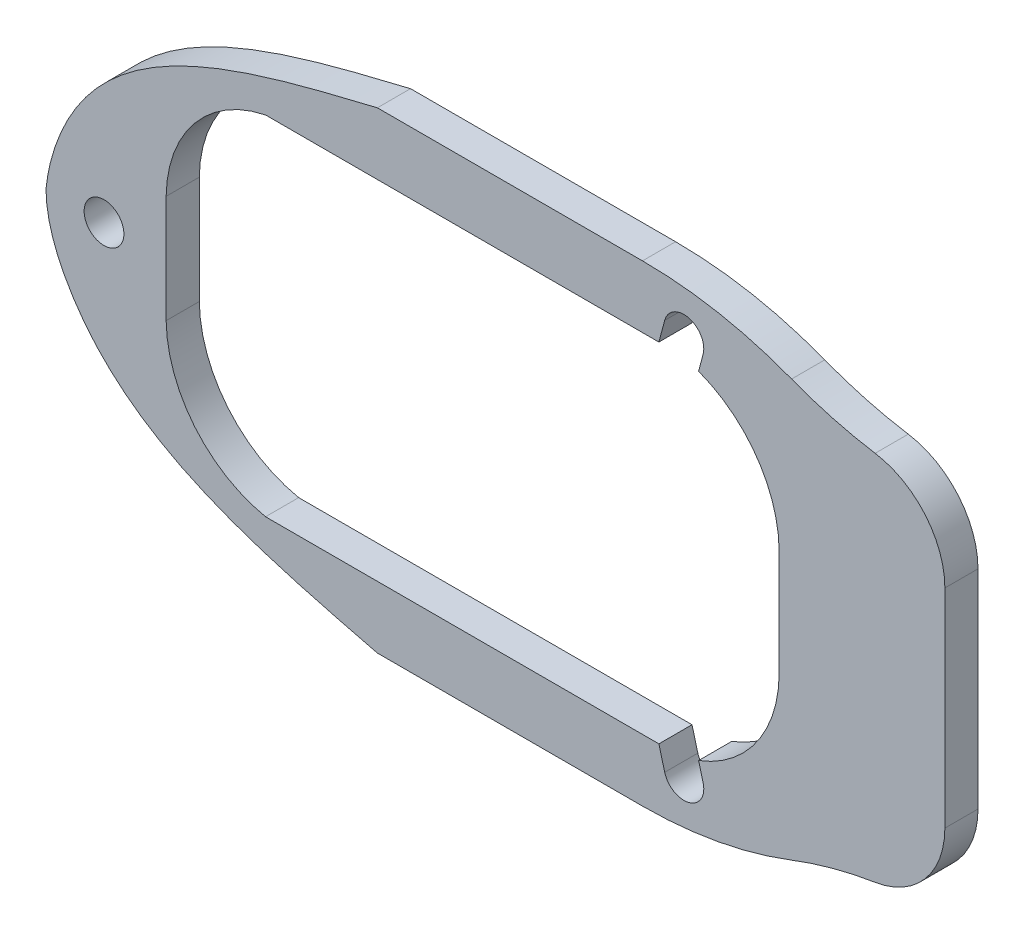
SolidWorks part; units mm, degrees
ref_plane "Face" through (0, 0, 0) normal (0, 0, 1) x (1, 0, 0)
ref_plane "Dessus" through (0, 0, 0) normal (0, 1, 0) x (1, 0, 0)
ref_plane "Droite" through (0, 0, 0) normal (1, 0, 0) x (0, 0, -1)
sketch "Esquisse1" plane through (0, 0, 0) normal (0, 0, 1) x (1, 0, 0)
  line L0 (-174.1176, 40.611) -> (-158.1176, 40.611)
  line L1 (-174.1176, 12.111) -> (-158.1176, 12.111)
  line L4 (-139.8676, 26.361) -> (-241.3155, 26.361) construction
  line L7 (-194.1176, 26.361) -> (-194.1176, 51.1644) construction
  line L13 (-139.8676, 32.6371) -> (-139.8676, 20.085)
  arc A0 (-144.076, 15.148) -> (-149.1176, 13.7872) centre (-140.1176, -9.5366) ccw
  arc A1 (-149.1176, 13.7872) -> (-158.1176, 12.111) centre (-158.1176, 37.111) cw
  arc A2 (-149.1176, 38.9348) -> (-158.1176, 40.611) centre (-158.1176, 15.611) ccw
  arc A3 (-144.076, 37.574) -> (-149.1176, 38.9348) centre (-140.1176, 62.2586) cw
  arc A4 (-139.8676, 20.085) -> (-144.076, 15.148) centre (-144.8676, 20.085) cw
  arc A5 (-144.076, 37.574) -> (-139.8676, 32.6371) centre (-144.8676, 32.6371) cw
  point P3 (-192.6592, 30.9164)
  point P6 (-139.8676, 15.4621)
  point P11 (-192.6592, 21.8056)
  point P31 (-139.8676, 37.2599)
  dimension "D2" = 5
  dimension "D4" = 5
  dimension "D5" = 54.25
  dimension "D15" = 25
  dimension "D16" = 25
  dimension "D3" = 14.25
  dimension "D6" = 16
  dimension "D7" = 9
  dimension "D14" = 20
extrude "Base-Extrusion" add sketch "Esquisse1" along normal blind 2
sketch "Esquisse2" plane through (0, 0, 2) normal (0, 0, 1) x (1, 0, 0)
  line L0 (-149.8676, 29.611) -> (-149.8676, 23.111)
  line L1 (-180.867, 36.861) -> (-155.867, 36.861)
  line L2 (-186.8663, 29.611) -> (-186.8663, 23.111)
  line L3 (-180.867, 15.861) -> (-155.867, 15.861)
  line L5 (-139.8676, 20.085) -> (-139.8676, 32.6371) construction
  line L7 (-194.3634, 26.361) -> (-139.7026, 26.361) construction
  arc A0 (-155.867, 36.861) -> (-149.8676, 29.611) centre (-157.367, 29.5125) cw
  arc A1 (-186.8663, 23.111) -> (-180.867, 15.861) centre (-179.367, 23.2095) ccw
  arc A2 (-155.867, 15.861) -> (-149.8676, 23.111) centre (-157.367, 23.2095) ccw
  arc A3 (-186.8663, 29.611) -> (-180.867, 36.861) centre (-179.367, 29.5125) cw
  point P1 (-149.8676, 26.361)
  point P11 (-186.8663, 26.361)
  dimension "D3" = 1.5
  dimension "D4" = 7.5
  dimension "D1" = 7.5
  dimension "D2" = 1.5
  dimension "D5" = 6.5
  dimension "D7" = 10
  dimension "D8" = 25
  dimension "D9" = 10.5
extrude "Enlèv. mat.-Extru.1" cut sketch "Esquisse2" against normal through all
sketch "Esquisse7" plane through (0, 0, 0) normal (0, 0, 1) x (1, 0, 0)
  line L0 (-141.6308, 26.361) -> (-194.5061, 26.361) construction
  circle A0 centre (-190.6176, 26.361) radius 1.2
  dimension "D1" = 3.5
  dimension "D2" = 2.4
extrude "Enlèv. mat.-Extru.4" cut sketch "Esquisse7" along normal through all
sketch "Esquisse8" plane through (0, 0, 0) normal (0, 0, 1) x (1, 0, 0)
  line L0 (-190.4611, 26.361) -> (-146.8594, 26.361) construction
  line L1 (-156.7767, 38.1716) -> (-157.5882, 35.1431)
  line L2 (-157.5882, 35.1431) -> (-155.27, 34.522)
  line L3 (-155.27, 34.522) -> (-154.4585, 37.5504)
  line L4 (-155.867, 36.861) -> (-180.867, 36.861) construction
  line L5 (-157.5882, 17.5789) -> (-155.27, 18.2001)
  line L6 (-156.7767, 14.5504) -> (-157.5882, 17.5789)
  line L7 (-155.27, 18.2001) -> (-154.4585, 15.1716)
  arc A0 (-154.4585, 37.5504) -> (-156.7767, 38.1716) centre (-155.6176, 37.861) ccw
  circle A1 centre (-190.6176, 26.361) radius 1.2 construction
  arc A2 (-154.4585, 15.1716) -> (-156.7767, 14.5504) centre (-155.6176, 14.861) cw
  dimension "D1" = 2.4
  dimension "D4" = 11.5
  dimension "D5" = 35
  dimension "D2" = 2.4
  dimension "D3" = 105
  dimension "D6" = 3.1353
extrude "Enlèv. mat.-Extru.5" cut sketch "Esquisse8" along normal through all
